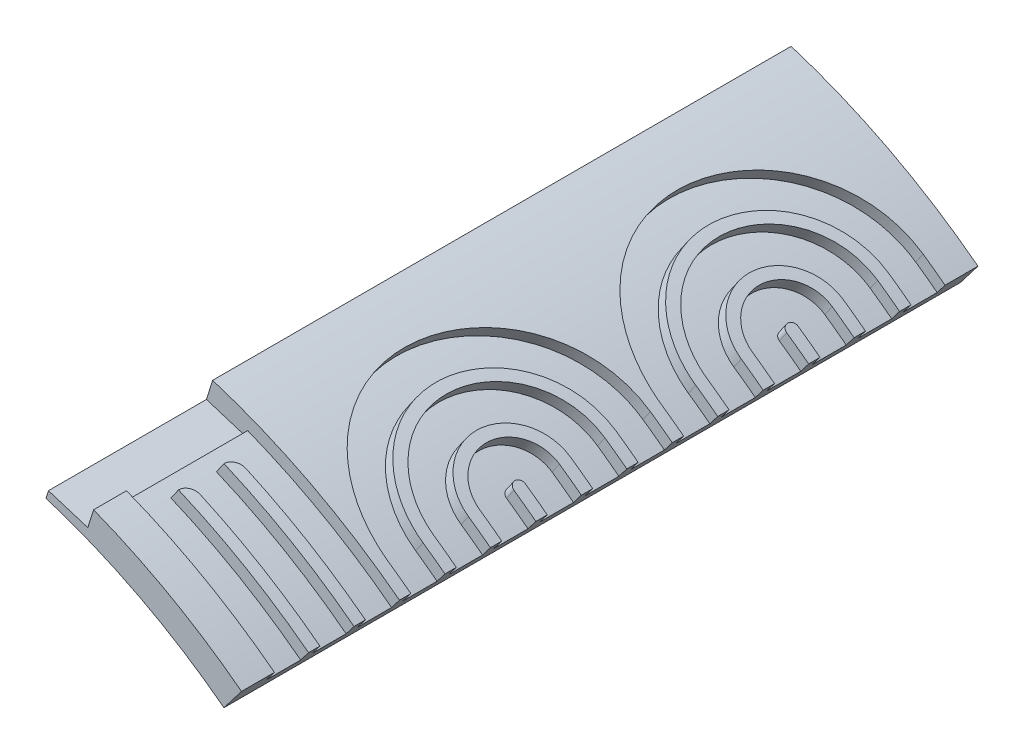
SolidWorks part; units mm, degrees
ref_plane "Přední rovina" through (0, 0, 0) normal (0, 0, 1) x (1, 0, 0)
ref_plane "Horní rovina" through (0, 0, 0) normal (0, 1, 0) x (1, 0, 0)
ref_plane "Pravá rovina" through (0, 0, 0) normal (1, 0, 0) x (0, 0, -1)
sketch "Skica1" plane through (0, 0, 0) normal (0, 0, 1) x (1, 0, 0)
  line L1 (140, -140) -> (-140, -140)
  line L2 (140, -140) -> (140, 140)
  line L3 (140, 140) -> (-140, 140)
  line L4 (-140, -140) -> (-140, 140)
  line L5 (140, -140) -> (-140, 140) construction
  line L6 (140, 140) -> (-140, -140) construction
  point P0 (0, 0)
  dimension "D1" = 280
  dimension "D2" = 280
extrude "Přidat vysunutím1" add sketch "Skica1" along normal blind 162
sketch "Skica2" plane through (0, 140, 0) normal (0, 1, 0) x (1, 0, 0)
  line L0 (-140, 0) -> (-140, -7.25)
  line L1 (-140, -162) -> (-140, 0) construction
  line L2 (-140, -7.25) -> (-140, -14.75)
  line L3 (-140, -14.75) -> (-140, -17.25)
  line L4 (-140, -17.25) -> (-140, -24.75)
  line L5 (-140, -24.75) -> (0, -24.75)
  line L6 (-140, -24.75) -> (-140, -27.25)
  line L7 (-140, -27.25) -> (0, -27.25)
  line L8 (-140, -27.25) -> (-140, -34.75)
  line L9 (-140, -34.75) -> (0, -34.75)
  line L10 (-140, -14.75) -> (0, -14.75)
  line L11 (-140, -37.25) -> (0, -37.25)
  line L12 (-140, -7.25) -> (0, -7.25)
  line L13 (-140, -17.25) -> (0, -17.25)
  line L14 (-140, -34.75) -> (-140, -36)
  line L15 (-140, -36) -> (140, -36) construction
  line L16 (140, -162) -> (140, 0) construction
  line L17 (0, 0) -> (0, -36) construction
  line L18 (-140, -44.75) -> (0, -44.75)
  line L19 (-140, -47.25) -> (0, -47.25)
  line L20 (-140, -54.75) -> (0, -54.75)
  line L21 (-140, -64.75) -> (0, -64.75)
  line L22 (-140, -57.25) -> (0, -57.25)
  line L23 (-140, -64.75) -> (-140, -67.25)
  line L24 (-140, -67.25) -> (-140, -74.75)
  line L25 (-140, -74.75) -> (-140, -77.25)
  line L26 (-140, -77.25) -> (-140, -84.75)
  line L27 (-140, -84.75) -> (0, -84.75)
  line L28 (-140, -84.75) -> (-140, -87.25)
  line L29 (-140, -87.25) -> (0, -87.25)
  line L30 (-140, -87.25) -> (-140, -94.75)
  line L31 (-140, -94.75) -> (0, -94.75)
  line L32 (-140, -74.75) -> (0, -74.75)
  line L33 (-140, -97.25) -> (0, -97.25)
  line L34 (-140, -67.25) -> (0, -67.25)
  line L35 (-140, -77.25) -> (0, -77.25)
  line L36 (-140, -94.75) -> (-140, -96)
  line L37 (0, -59.75) -> (0, -96) construction
  line L38 (-140, -104.75) -> (0, -104.75)
  line L39 (-140, -107.25) -> (0, -107.25)
  line L40 (-140, -114.75) -> (0, -114.75)
  line L41 (-140, -124.75) -> (0, -124.75)
  line L42 (-140, -117.25) -> (0, -117.25)
  line L43 (0, 0) -> (40, 0) construction
  line L44 (140, 0) -> (-140, 0) construction
  line L45 (40, 0) -> (40, -154.75) construction
  line L46 (140, -162) -> (-140, -162) construction
  line L47 (-140, -124.75) -> (-140, -127.25)
  line L48 (-140, -127.25) -> (32.8902, -127.25)
  line L49 (-140, -127.25) -> (-140, -134.75)
  line L50 (-140, -134.75) -> (24.5559, -134.75)
  line L51 (-140, -134.75) -> (-140, -137.25)
  line L52 (-140, -137.25) -> (-140, -144.75)
  line L53 (-140, -137.25) -> (27.0559, -137.25)
  line L54 (-140, -144.75) -> (24.5559, -144.75)
  line L55 (-140, -144.75) -> (-140, -147.25)
  line L56 (-140, -147.25) -> (27.0559, -147.25)
  line L57 (-140, -147.25) -> (-140, -154.75)
  line L58 (-140, -154.75) -> (30.93, -154.75)
  line L59 (30.93, -154.75) -> (40, -154.75)
  line L60 (40, -154.75) -> (40, -127.25)
  arc A0 (0, -27.25) -> (0, -44.75) centre (0, -36) cw
  arc A1 (0, -24.75) -> (0, -47.25) centre (0, -36) cw
  arc A2 (0, -17.25) -> (0, -54.75) centre (0, -36) cw
  arc A3 (0, -14.75) -> (0, -57.25) centre (0, -36) cw
  arc A4 (0, -7.25) -> (0, -64.75) centre (0, -36) cw
  arc A5 (1.25, -36) -> (0, -34.75) centre (0, -36) ccw
  arc A6 (0, -37.25) -> (1.25, -36) centre (0, -36) ccw
  arc A7 (0, -87.25) -> (0, -104.75) centre (0, -96) cw
  arc A8 (0, -84.75) -> (0, -107.25) centre (0, -96) cw
  arc A9 (0, -77.25) -> (0, -114.75) centre (0, -96) cw
  arc A10 (0, -74.75) -> (0, -117.25) centre (0, -96) cw
  arc A11 (0, -67.25) -> (0, -124.75) centre (0, -96) cw
  arc A12 (1.25, -96) -> (0, -94.75) centre (0, -96) ccw
  arc A13 (0, -97.25) -> (1.25, -96) centre (0, -96) ccw
  arc A15 (40, -134.75) -> (32.0884, -127.25) centre (32.4893, -134.75) ccw
  arc A16 (27.0559, -137.25) -> (24.5559, -134.75) centre (24.5559, -137.25) ccw
  arc A17 (27.0559, -147.25) -> (24.5559, -144.75) centre (24.5559, -147.25) ccw
  dimension "D8" = 28.75
  dimension "D9" = 21.25
  dimension "D10" = 18.75
  dimension "D11" = 11.25
  dimension "D12" = 8.75
  dimension "D13" = 28.75
  dimension "D40" = 21.25
  dimension "D41" = 18.75
  dimension "D42" = 11.25
  dimension "D43" = 8.75
  dimension "D44" = 1.25
  dimension "D1" = 7.25
  dimension "D2" = 7.5
  dimension "D3" = 2.5
  dimension "D5" = 2.5
  dimension "D4" = 7.5
  dimension "D6" = 7.5
  dimension "D7" = 1.25
  dimension "D14" = 2.5
  dimension "D15" = 40
  dimension "D16" = 2.5
  dimension "D17" = 7.5
  dimension "D18" = 2.5
  dimension "D19" = 7.5
  dimension "D20" = 2.5
  dimension "D21" = 7.5
  dimension "D22" = 7.25
  dimension "D23" = 7.5
  dimension "D24" = 2.5
  dimension "D25" = 7.5
  dimension "D26" = 2.5
  dimension "D27" = 7.5
  dimension "D28" = 2.5
  dimension "D29" = 7.5
  dimension "D30" = 2.5
  dimension "D31" = 7.5
  dimension "D32" = 2.5
  dimension "D33" = 7.5
  dimension "D34" = 7.5
  dimension "D35" = 2.5
  dimension "D36" = 7.5
  dimension "D37" = 2.5
  dimension "D38" = 7.5
  dimension "D39" = 2.5
extrude "Odebrat vysunutím1" cut sketch "Skica2" against normal through all
sketch "Skica3" plane through (0, 0, 0) normal (0, 0, -1) x (-1, 0, 0)
  line L0 (0, 0) -> (-40, 0)
  line L1 (-140, 140) -> (140, 140)
  line L2 (-140, 140) -> (-140, -140)
  line L3 (-140, -140) -> (140, -140)
  line L4 (140, 140) -> (140, -140)
  line L6 (0, 0) -> (-40, 127.3666)
  line L7 (0, 0) -> (5.9742, 133.3663)
  line L8 (-40, -140) -> (-40, 140) construction
  circle A0 centre (0, 0) radius 130.5
  circle A1 centre (0, 0) radius 133.5
  dimension "D1" = 261
  dimension "D2" = 267
  dimension "D3" = 40
  dimension "D4" = 20
extrude "Odebrat vysunutím3" cut sketch "Skica3" against normal through all
ref_plane "Rovina3" through (0, 0, 0) normal (0.9541, -0.2996, 0) x (0, 0, -1)
mirror "Zrcadlit10" about plane through (0, 0, 0) normal (0.9541, -0.2996, 0)
sketch "Skica5" plane through (0, 0, 162) normal (0, 0, 1) x (1, 0, 0)
  line L0 (0, 0) -> (-5.9742, 133.3663)
  line L1 (-5.9742, 133.3663) -> (-6.1309, 136.8628)
  line L2 (0, 0) -> (39.1011, 124.5044)
  line L3 (39.1011, 124.5044) -> (41.0487, 130.7058)
  line L4 (0, 0) -> (79.3261, 103.6225)
  line L5 (79.3261, 103.6225) -> (83.2772, 108.7838)
  circle A0 centre (0, 0) radius 137
  circle A1 centre (0, 0) radius 127
  circle A2 centre (0, 0) radius 130.5
  circle A3 centre (0, 0) radius 133.5
  dimension "D1" = 254
  dimension "D2" = 274
extrude "Přidat vysunutím2" add sketch "Skica5" against normal through all contours A1 L2 L0 M1 | L4 A2 L2 A1 | A3 L5 A0 L3 | L3 A0 L1 M3
sketch "Skica9" plane through (0, 0, 162) normal (0, 0, 1) x (1, 0, 0)
  line L0 (0, 0) -> (40.4494, 128.7977)
  line L1 (-16.4794, -52.4731) -> (16.4794, 52.4731) construction
  line L2 (40.4494, 128.7977) -> (38.5948, 122.8921)
  line L3 (40.4494, 128.7977) -> (38.5948, 122.8921)
  line L4 (31.7961, 131.5153) -> (49.1027, 126.0801)
  line L5 (29.9415, 125.6097) -> (47.2481, 120.1745)
  line L6 (49.1027, 126.0801) -> (47.2481, 120.1745)
  line L7 (31.7961, 131.5153) -> (29.9415, 125.6097)
  circle A0 centre (0, 0) radius 135
  dimension "D1" = 270
  dimension "D2" = 6.19
  dimension "D3" = 9.07
extrude "Odebrat vysunutím4" cut sketch "Skica9" against normal blind 34.75 contours L0 A0 L7 L5 | L6 A0 L0 L5 | A0 L6 L4 | A0 L4 L7
sketch "Skica11" plane through (0, 0, 162) normal (0, 0, 1) x (1, 0, 0)
  line L0 (0, 0) -> (-6.1309, 136.8628)
  line L1 (0, 0) -> (41.0487, 130.7058)
  line L2 (-16.4794, -52.4731) -> (16.4794, 52.4731) construction
  line L3 (0, 0) -> (83.2772, 108.7838)
  circle A0 centre (0, 0) radius 137
  dimension "D1" = 20
extrude "Odebrat vysunutím5" cut sketch "Skica11" against normal through all contours L1 M11 M4 M5 M6 M9 M10 | L0 L1 M11 | L1 M4 M6 M5
scale "Měřítko1" scale about centroid uniform scaling yes scale factor 0.655
sketch "Skica12" plane through (0, 0, 27.0681) normal (0, 0, -1) x (-1, 0, 0)
  line L0 (-73.8683, 109.7585) -> (-72.6738, 108.1983) construction
  line L1 (-73.8683, 109.7585) -> (-72.6738, 108.1983)
  line L2 (-45.6396, 119.6887) -> (-47.6022, 125.9378)
  line L3 (-75.2618, 111.5789) -> (-71.2803, 106.3779)
  line L4 (-45.6396, 119.6887) -> (-47.6022, 125.9378)
  line L5 (-75.2618, 111.5789) -> (-71.2803, 106.3779)
  line L6 (-71.2803, 106.3779) -> (-75.2618, 111.5789) construction
  circle A0 centre (-20.7153, 40.3255) radius 87.3425
  arc A2 (-45.6396, 119.6887) -> (-71.2803, 106.3779) centre (-20.7153, 40.3255) ccw
  arc A3 (-47.6022, 125.9378) -> (-75.2618, 111.5789) centre (-20.7153, 40.3255) ccw
  arc A4 (-45.6396, 119.6887) -> (-71.2803, 106.3779) centre (-20.7153, 40.3255) ccw
  arc A5 (-47.6022, 125.9378) -> (-75.2618, 111.5789) centre (-20.7153, 40.3255) ccw
  point P3 (-73.8075, 109.6791)
  point P10 (-73.5462, 109.3378)
  dimension "D2" = 0.1
  dimension "D1" = 0
extrude "Odebrat vysunutím6" cut sketch "Skica12" against normal through all contours A0 L4 M7 M8
